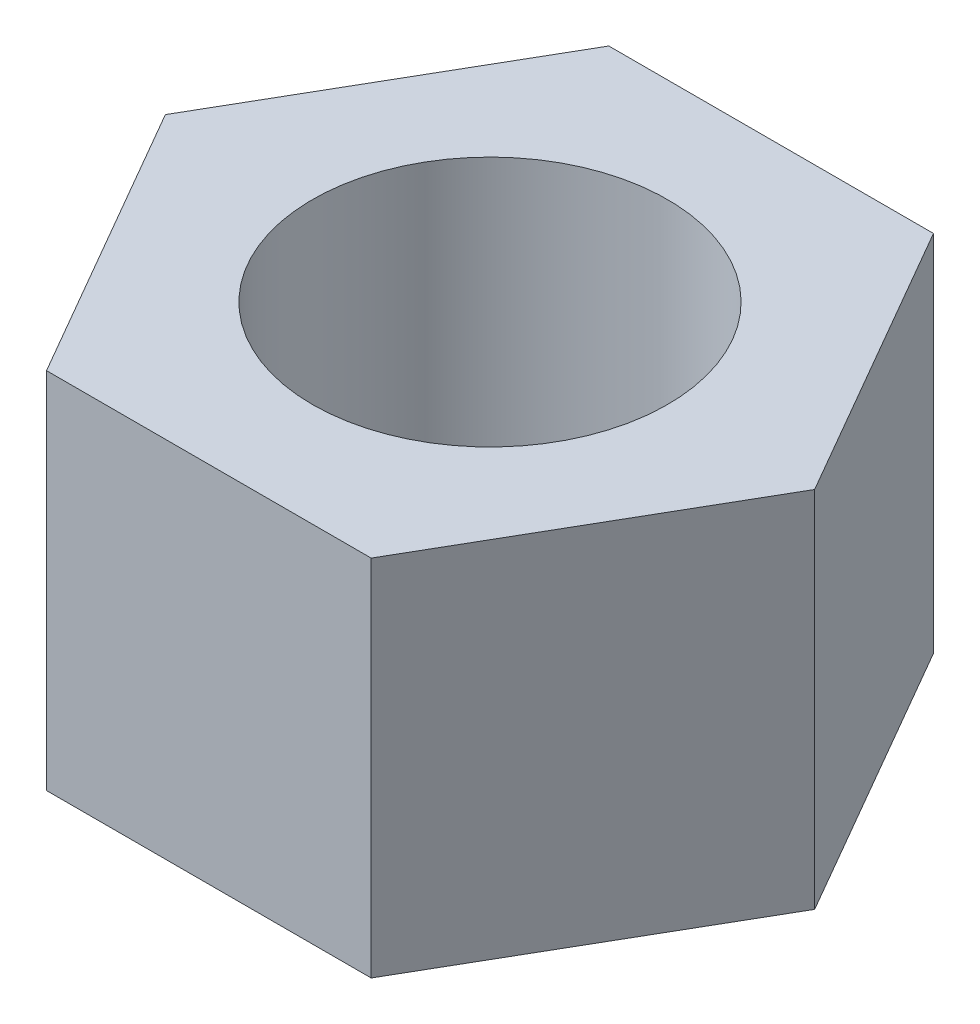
SolidWorks part; units mm, degrees
ref_plane "Front Plane" through (0, 0, 0) normal (0, 0, 1) x (1, 0, 0)
ref_plane "Top Plane" through (0, 0, 0) normal (0, 1, 0) x (1, 0, 0)
ref_plane "Right Plane" through (0, 0, 0) normal (1, 0, 0) x (0, 0, -1)
sketch "Sketch2" plane through (0, 0, 0) normal (0, 1, 0) x (1, 0, 0)
  circle A0 centre (0, 0) radius 19.05
  dimension "D1" = 38.1
sketch "Sketch3" plane through (0, 0, 0) normal (0, 1, 0) x (1, 0, 0)
  line L1 (17.4143, -30.1625) -> (34.8287, 0)
  line L2 (34.8287, 0) -> (17.4143, 30.1625)
  line L3 (17.4143, 30.1625) -> (-17.4143, 30.1625)
  line L4 (-17.4143, 30.1625) -> (-34.8287, 0)
  line L5 (-34.8287, 0) -> (-17.4143, -30.1625)
  line L6 (-17.4143, -30.1625) -> (17.4143, -30.1625)
  circle A0 centre (0, 0) radius 30.1625 construction
  dimension "D1" = 60.325
extrude "Boss-Extrude1" add sketch "Sketch3" along normal blind 39.0144
extrude "Cut-Extrude1" cut sketch "Sketch2" along normal blind 101.6
